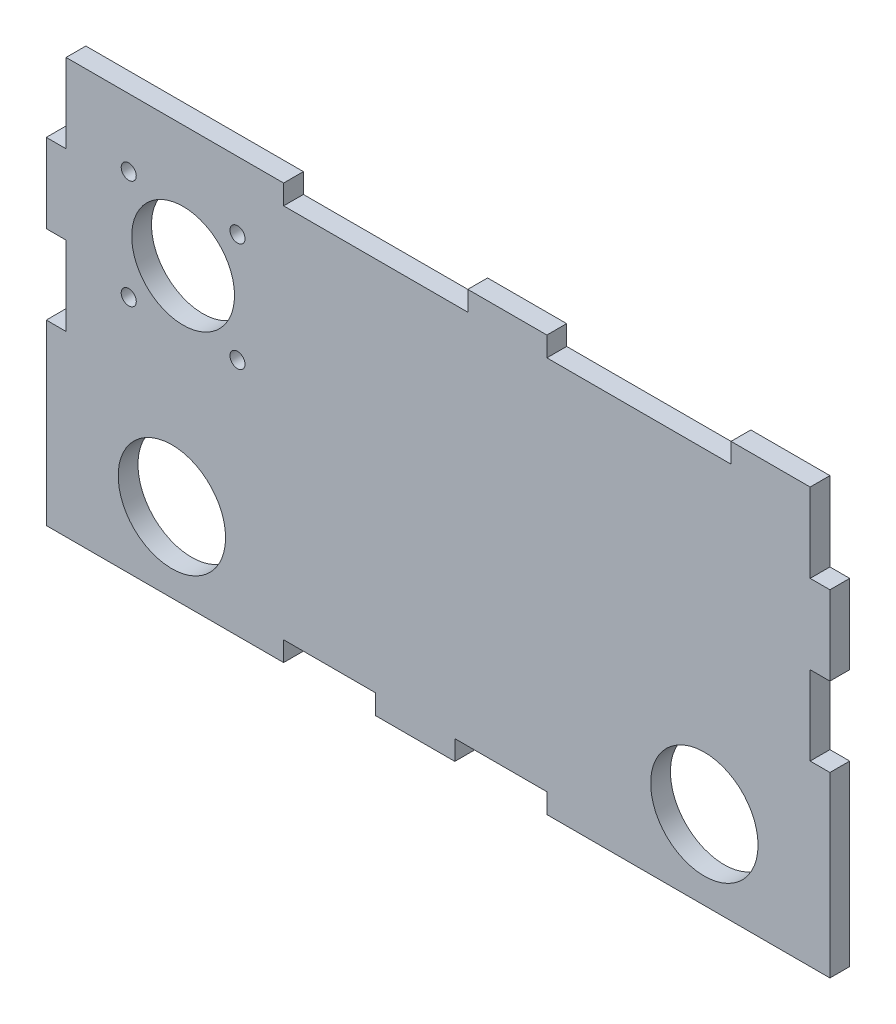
SolidWorks part; units mm, degrees
ref_plane "Front Plane" through (0, 0, 0) normal (0, 0, 1) x (1, 0, 0)
ref_plane "Top Plane" through (0, 0, 0) normal (0, 1, 0) x (1, 0, 0)
ref_plane "Right Plane" through (0, 0, 0) normal (1, 0, 0) x (0, 0, -1)
sketch "Sketch1" plane through (0, 0, 0) normal (0, 0, 1) x (1, 0, 0)
  line L0 (20.8422, 87.9243) -> (34.591, 74.1756) construction
  line L1 (0, 0) -> (198.12, 0) construction
  line L2 (0, 0) -> (0, 105) construction
  line L3 (0, 105) -> (198.12, 105) construction
  line L4 (198.12, 0) -> (198.12, 105) construction
  line L5 (34.591, 74.1756) -> (48.3398, 87.9243) construction
  line L6 (5, 105) -> (5, 0) construction
  line L7 (0, 0) -> (0, 45)
  line L8 (0, 45) -> (5, 45)
  line L9 (5, 45) -> (5, 65)
  line L10 (5, 65) -> (0, 65)
  line L11 (0, 65) -> (0, 85)
  line L12 (0, 85) -> (5, 85)
  line L13 (5, 85) -> (5, 105)
  line L14 (5, 105) -> (60, 105)
  line L15 (60, 105) -> (60, 100)
  line L16 (60, 100) -> (106.56, 100)
  line L17 (106.56, 100) -> (106.56, 105)
  line L18 (106.56, 105) -> (126.56, 105)
  line L19 (126.56, 105) -> (126.56, 100)
  line L20 (126.56, 100) -> (173.12, 100)
  line L21 (173.12, 100) -> (173.12, 105)
  line L22 (173.12, 105) -> (193.12, 105)
  line L23 (193.12, 105) -> (193.12, 85)
  line L24 (193.12, 85) -> (198.12, 85)
  line L25 (198.12, 85) -> (198.12, 65)
  line L26 (198.12, 65) -> (193.12, 65)
  line L27 (193.12, 65) -> (193.12, 45)
  line L28 (193.12, 45) -> (198.12, 45)
  line L29 (198.12, 45) -> (198.12, 0)
  line L30 (0, 0) -> (60, 0)
  line L31 (60, 0) -> (60, 5)
  line L32 (60, 5) -> (83.28, 5)
  line L33 (83.28, 5) -> (83.28, 0)
  line L34 (83.28, 0) -> (103.28, 0)
  line L35 (103.28, 0) -> (103.28, 5)
  line L36 (103.28, 5) -> (126.56, 5)
  line L37 (126.56, 5) -> (126.56, 0)
  line L38 (126.56, 0) -> (198.12, 0)
  circle A0 centre (31.75, 20) radius 13.575
  circle A1 centre (80.01, 46.3813) radius 13.575 construction
  circle A2 centre (118.11, 46.3813) radius 13.575 construction
  circle A3 centre (166.37, 20) radius 13.575
  circle A4 centre (31.75, 20) radius 55 construction
  circle A5 centre (31.75, 20) radius 31.75 construction
  circle A6 centre (166.37, 20) radius 55 construction
  circle A7 centre (166.37, 20) radius 31.75 construction
  circle A8 centre (31.75, 20) radius 54.25 construction
  circle A9 centre (34.591, 74.1756) radius 19.4437 construction
  circle A10 centre (20.8422, 87.9243) radius 1.905
  circle A11 centre (20.8422, 60.4268) radius 1.905
  circle A12 centre (48.3398, 60.4268) radius 1.905
  circle A13 centre (48.3398, 87.9243) radius 1.905
  circle A14 centre (34.591, 74.1756) radius 29.591 construction
  circle A15 centre (34.591, 74.1756) radius 13
  dimension "D1" = 63.5
  dimension "D2" = 27.15
  dimension "D5" = 110
  dimension "D8" = 108.5
  dimension "D9" = 38.8874
  dimension "D10" = 3.81
  dimension "D11" = 59.182
  dimension "D21" = 26
  dimension "D3" = 38.1
  dimension "D4" = 134.62
  dimension "D6" = 198.12
  dimension "D7" = 105
  dimension "D12" = 20
  dimension "D13" = 5
  dimension "D14" = 20
  dimension "D15" = 20
  dimension "D16" = 45
  dimension "D17" = 20
  dimension "D18" = 20
  dimension "D19" = 55
  dimension "D20" = 5
  dimension "D22" = 20
extrude "Boss-Extrude1" add sketch "Sketch1" along normal blind 5
